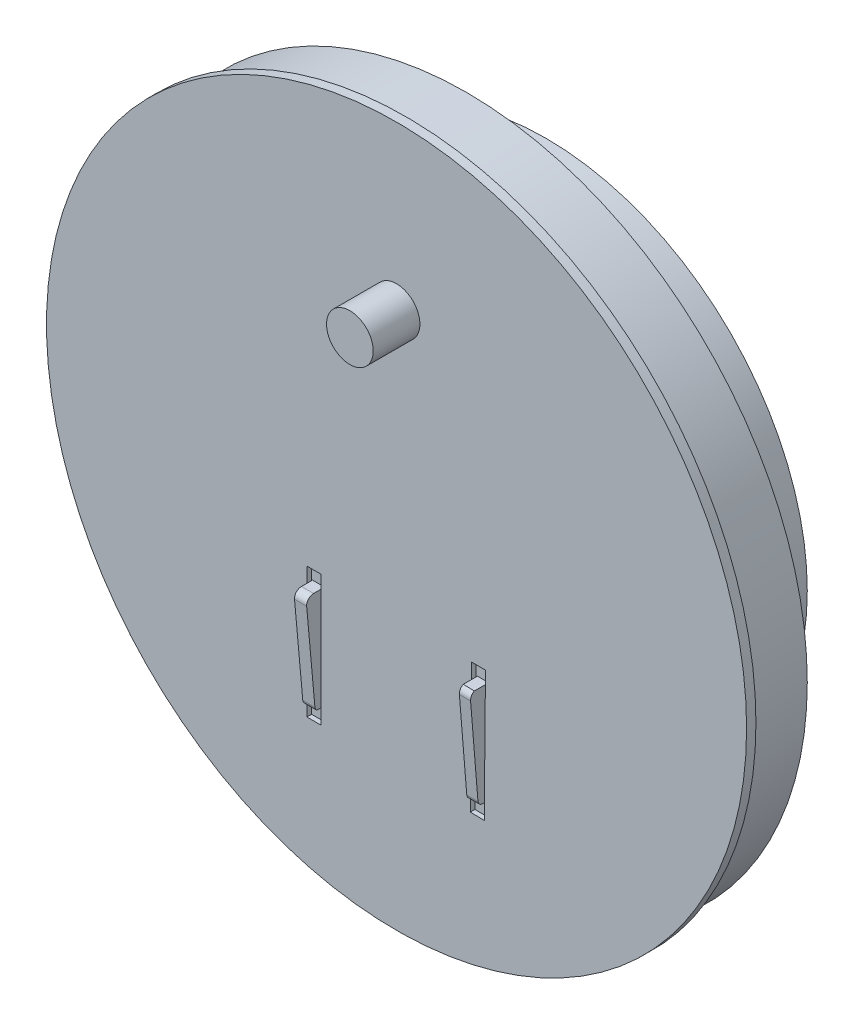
SolidWorks part; units mm, degrees
ref_plane "Alzado" through (0, 0, 0) normal (0, 0, 1) x (1, 0, 0)
ref_plane "Planta" through (0, 0, 0) normal (0, 1, 0) x (1, 0, 0)
ref_plane "Vista lateral" through (0, 0, 0) normal (1, 0, 0) x (0, 0, -1)
sketch "Croquis1" plane through (0, 0, 0) normal (0, 0, 1) x (1, 0, 0)
  circle A0 centre (0, 0) radius 75
  dimension "D1" = 150
extrude "Saliente-Extruir1" add sketch "Croquis1" along normal blind 2
sketch "Croquis2" plane through (0, 0, 0) normal (0, 0, -1) x (-1, 0, 0)
  circle A0 centre (0, 0) radius 73
extrude "Saliente-Extruir2" add sketch "Croquis2" along normal blind 13
sketch "Croquis3" plane through (0, 0, -13) normal (0, 0, -1) x (-1, 0, 0)
  circle A0 centre (0, 0) radius 56
extrude "Saliente-Extruir3" add sketch "Croquis3" along normal blind 17
shell "Vaciado1" thickness 1
sketch "Croquis4" plane through (0, 0, 2) normal (0, 0, 1) x (1, 0, 0)
  line L0 (0, 90.2293) -> (0, -90.2293) construction
  circle A0 centre (0, 40) radius 5
  circle A1 centre (0, 0) radius 75 construction
  point P4 (0, 0)
  dimension "D1" = 10
  dimension "D2" = 40
extrude "Saliente-Extruir4" add sketch "Croquis4" along normal blind 10
sketch "Croquis6" plane through (0, 0, 1) normal (0, 0, -1) x (-1, 0, 0)
  line L16 (-21.7604, -48.2059) -> (-22.0788, -14.2074)
  line L17 (-22.0788, -14.2074) -> (-13.0792, -14.1231)
  line L18 (-13.0792, -14.1231) -> (-12.7608, -48.1216)
  line L19 (-12.7608, -48.1216) -> (-21.7604, -48.2059)
  line L20 (13.2109, -48) -> (13.2109, -14)
  line L21 (13.2109, -14) -> (22.2109, -14)
  line L22 (22.2109, -14) -> (22.2109, -48)
  line L23 (22.2109, -48) -> (13.2109, -48)
  circle A1 centre (0, 0) radius 72
  circle A2 centre (0, 0) radius 72
  dimension "D1" = 0
extrude "Saliente-Extruir5" add sketch "Croquis6" along normal blind 10 separate body
sketch "Croquis5" plane through (0, 0, 2) normal (0, 0, 1) x (1, 0, 0)
  line L0 (-98.2549, -45) -> (97.8335, -45) construction
  line L1 (0, 0) -> (-0.2107, -45) construction
  line L2 (-17.4998, 0.0821) -> (-17.7109, -45) construction
  line L3 (17.4998, -0.0819) -> (17.2891, -45.0819) construction
  line L4 (-17.4998, 0.0819) -> (-17.7105, -44.9181) construction
  line L9 (-19.2109, -45) -> (-16.2109, -45)
  line L10 (-19.2109, -45) -> (-19.2109, -17)
  line L11 (-19.2109, -17) -> (-16.2109, -17)
  line L12 (-16.2109, -45) -> (-16.2109, -17)
  line L13 (19.0509, -17.1791) -> (16.051, -17.1511)
  line L14 (15.7888, -45.1498) -> (16.051, -17.1511)
  line L15 (18.7887, -45.1779) -> (15.7888, -45.1498)
  line L16 (18.7887, -45.1779) -> (19.0509, -17.1791)
  circle A0 centre (0, 0) radius 75 construction
  point P11 (-17.6053, -22.459)
  point P16 (-17.7109, -45)
  dimension "D1" = 45
  dimension "D2" = 17.5
  dimension "D4" = 28
  dimension "D5" = 3
  dimension "D3" = 17.5
extrude "Cortar-Extruir1" cut sketch "Croquis5" against normal blind 15
ref_plane "Plano1" through (0, 0, 1) normal (0, 0, 1) x (1, 0, 0)
sketch "Croquis7" plane through (0, 0, 1) normal (0, 0, 1) x (1, 0, 0)
  line L0 (17.5228, -20.165) -> (17.3168, -42.164) construction
  line L2 (15.7888, -45.1498) -> (18.7887, -45.1779) construction
  line L3 (-17.7109, -45) -> (17.2887, -45.1639) construction
  line L4 (-19.2109, -45) -> (-16.2109, -45) construction
  line L5 (-0.2111, -45.0819) -> (-0.2111, -15.7928) construction
  line L8 (19.0228, -20.179) -> (16.0229, -20.1509)
  line L9 (18.7228, -20.1762) -> (16.3229, -20.1537)
  line L11 (15.8169, -42.15) -> (18.8168, -42.1781)
  line L12 (16.1169, -42.1528) -> (18.5168, -42.1752)
  line L14 (16.351, -17.1539) -> (16.0888, -45.1526)
  line L15 (16.3229, -20.1537) -> (16.1169, -42.1528)
  line L17 (18.4887, -45.1751) -> (18.7509, -17.1763)
  line L18 (18.5168, -42.1752) -> (18.7228, -20.1762)
  line L21 (-16.2109, -20) -> (-19.2109, -20)
  line L22 (-16.4109, -20) -> (-19.0109, -20)
  line L24 (-19.2109, -42) -> (-16.2109, -42)
  line L25 (-19.0109, -42) -> (-16.4109, -42)
  line L27 (-19.0109, -17) -> (-19.0109, -45)
  line L28 (-19.0109, -20) -> (-19.0109, -42)
  line L30 (-16.4109, -45) -> (-16.4109, -17)
  line L31 (-16.4109, -42) -> (-16.4109, -20)
  dimension "D1" = 3
  dimension "D2" = 3
  dimension "D3" = 0.2
  dimension "D4" = 0.2
  dimension "D5" = 3
  dimension "D6" = 3
  dimension "D7" = 0.3
  dimension "D8" = 0.3
extrude "Saliente-Extruir6" add sketch "Croquis7" along normal blind 4
sketch "Croquis8" plane through (-19.0109, 0, 0) normal (-1, 0, 0) x (0, 0, 1)
  line L3 (4.8526, -21.6347) -> (3.0821, -41.2651)
  line L5 (5, -42.1752) -> (1, -42.1752) construction
  line L12 (2.1793, -20) -> (2.1793, -19.161)
  line L13 (2.1793, -19.161) -> (6.2037, -19.161)
  line L14 (6.2037, -19.161) -> (6.2037, -43.1775)
  line L15 (6.2037, -43.1775) -> (2.0861, -43.1775)
  line L16 (2.0861, -43.1775) -> (2.0861, -42.1752)
  line L17 (3.3586, -20) -> (2.1793, -20)
  arc A0 (4.8526, -21.6347) -> (3.3586, -20) centre (3.3586, -21.5) ccw
  arc A1 (3.0821, -41.2651) -> (2.0861, -42.1752) centre (2.0861, -41.1752) cw
  point P12 (5, -20)
  point P15 (3, -42.1752)
  dimension "D1" = 1.5
  dimension "D2" = 1
extrude "Cortar-Extruir3" cut sketch "Croquis8" against normal blind 44
